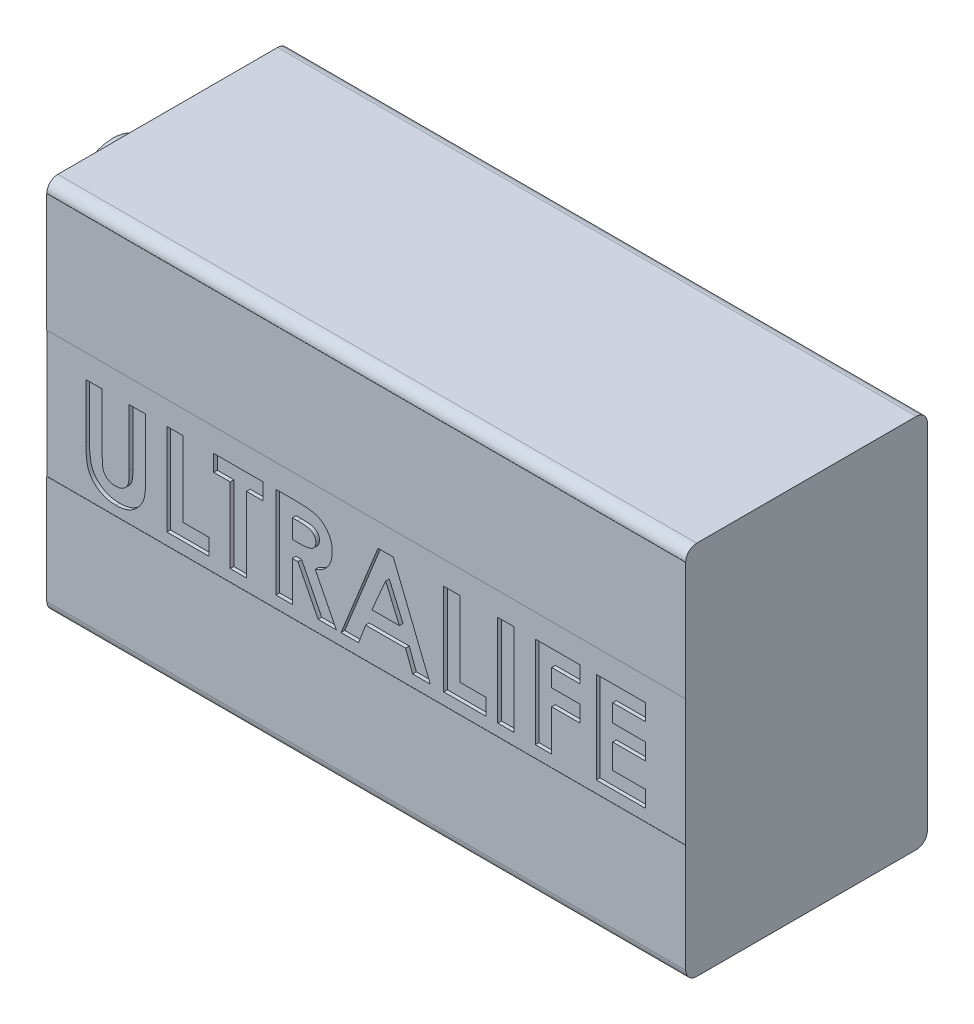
SolidWorks part; units mm, degrees
ref_plane "Front" through (0, 0, 0) normal (0, 0, 1) x (1, 0, 0)
ref_plane "Top" through (0, 0, 0) normal (0, 1, 0) x (1, 0, 0)
ref_plane "Right" through (0, 0, 0) normal (1, 0, 0) x (0, 0, -1)
sketch "Sketch1" plane through (0, 0, 0) normal (0, 0, 1) x (1, 0, 0)
  line L1 (-15.2891, 21.8653) -> (29.0339, 21.8653)
  line L2 (-15.2891, 21.8653) -> (-15.2891, -4.1697)
  line L3 (-15.2891, -4.1697) -> (29.0339, -4.1697)
  line L4 (29.0339, 21.8653) -> (29.0339, -4.1697)
  dimension "D1" = 44.323
  dimension "D2" = 26.035
extrude "Extrude1" add sketch "Sketch1" along normal blind 16.764
fillet "Fillet1" radius 0.762 4 edges at (6.8724, -4.1697, 0) (6.8724, -4.1697, 16.764) (6.8724, 21.8653, 0) (6.8724, 21.8653, 16.764)
sketch "Sketch2" plane through (0, 0, 16.764) normal (0, 0, 1) x (1, 0, 0)
  text T0 "<b>ULTRALIFE</b>" font "Century Gothic" height 6.35
extrude "Cut-Extrude1" cut sketch "Sketch2" against normal blind 0.254
sketch "Sketch3" plane through (-15.2891, 0, 0) normal (-1, 0, 0) x (0, 0, 1)
  line L0 (16.002, 21.8653) -> (0.762, 21.8653) construction
  line L1 (4.0485, 0.3675) -> (8.3402, -2.1705)
  line L2 (8.3402, -2.1705) -> (12.684, 0.2773)
  line L3 (12.684, 0.2773) -> (12.7361, 5.263)
  line L4 (12.7361, 5.263) -> (8.4444, 7.801)
  line L5 (8.4444, 7.801) -> (4.1006, 5.3533)
  line L6 (4.1006, 5.3533) -> (4.0485, 0.3675)
  line L7 (8.382, 15.5153) -> (8.382, -7.6171) construction
  line L8 (0, 21.1033) -> (0, -3.4077) construction
  circle A0 centre (8.382, 15.5153) radius 2.8043
  circle A1 centre (8.382, 15.5153) radius 2.3821
  circle A2 centre (8.3923, 2.8153) radius 2.921
  circle A3 centre (8.3923, 2.8153) radius 4.318 construction
  dimension "D1" = 5.842
  dimension "D2" = 12.7
  dimension "D3" = 6.35
  dimension "D4" = 8.382
sketch "Sketch4" plane through (0, 0, 16.764) normal (0, 0, 1) x (1, 0, 0)
  line L0 (29.0339, -3.4077) -> (29.0339, 21.1033) construction
  line L1 (-15.2891, 21.1033) -> (29.0339, 21.1033)
  line L2 (-15.2891, 21.1033) -> (-15.2891, 12.9003)
  line L3 (-15.2891, 12.9003) -> (29.0339, 12.9003)
  line L4 (29.0339, 21.1033) -> (29.0339, 12.9003)
  line L5 (-15.2891, 7.1333) -> (-15.2891, -1.5027) construction
  line L6 (29.0339, -3.4077) -> (-15.2891, -3.4077)
  line L7 (29.0339, -3.4077) -> (29.0339, 4.1059)
  line L8 (29.0339, 4.1059) -> (-15.2891, 4.1059)
  line L9 (-15.2891, -3.4077) -> (-15.2891, 4.1059)
extrude "Extrude3" add sketch "Sketch4" along normal blind 0.0127
extrude "Extrude4" add sketch "Sketch3" along normal blind 3.81
